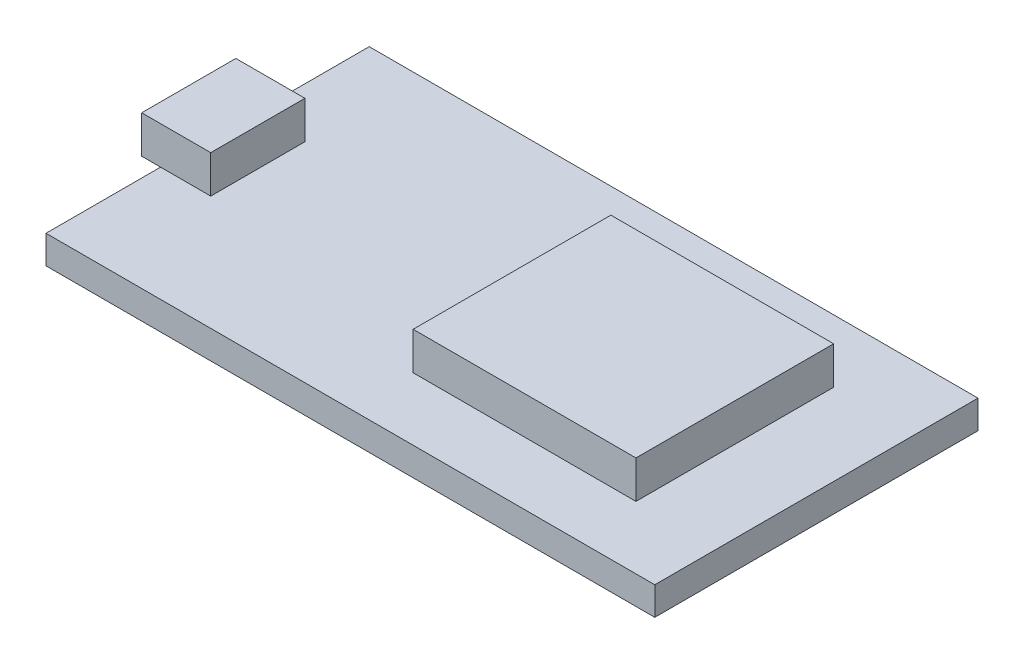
SolidWorks part; units mm, degrees
ref_plane "Front Plane" through (0, 0, 0) normal (0, 0, 1) x (1, 0, 0)
ref_plane "Top Plane" through (0, 0, 0) normal (0, 1, 0) x (1, 0, 0)
ref_plane "Right Plane" through (0, 0, 0) normal (1, 0, 0) x (0, 0, -1)
sketch "Sketch2" plane through (0, 0, 0) normal (0, 1, 0) x (1, 0, 0)
  line L1 (0, 0) -> (48.5, 0)
  line L2 (0, 0) -> (0, 25.75)
  line L3 (0, 25.75) -> (48.5, 25.75)
  line L4 (48.5, 0) -> (48.5, 25.75)
  dimension "D1" = 48.5
  dimension "D2" = 25.75
extrude "Boss-Extrude1" add sketch "Sketch2" along normal blind 2.25
sketch "Sketch3" plane through (0, 2.25, 0) normal (0, 1, 0) x (1, 0, 0)
  line L0 (0, 12.875) -> (48.5, 12.875) construction
  line L1 (24.25, 20.75) -> (42, 20.75)
  line L2 (24.25, 20.75) -> (24.25, 5)
  line L3 (24.25, 5) -> (42, 5)
  line L4 (42, 20.75) -> (42, 5)
  line L5 (0, 25.75) -> (0, 0) construction
  line L6 (48.5, 0) -> (48.5, 25.75) construction
  line L8 (4, 9.125) -> (-1.5, 9.125)
  line L9 (4, 9.125) -> (4, 16.625)
  line L10 (4, 16.625) -> (-1.5, 16.625)
  line L11 (-1.5, 9.125) -> (-1.5, 16.625)
  point P10 (24.25, 12.875)
  point P15 (4, 12.875)
  dimension "D1" = 17.75
  dimension "D2" = 15.75
  dimension "D3" = 6.5
  dimension "D4" = 5.5
  dimension "D5" = 7.5
  dimension "D6" = 1.5
extrude "Boss-Extrude2" add sketch "Sketch3" along normal blind 3
shell "Shell1" thickness 0.5
